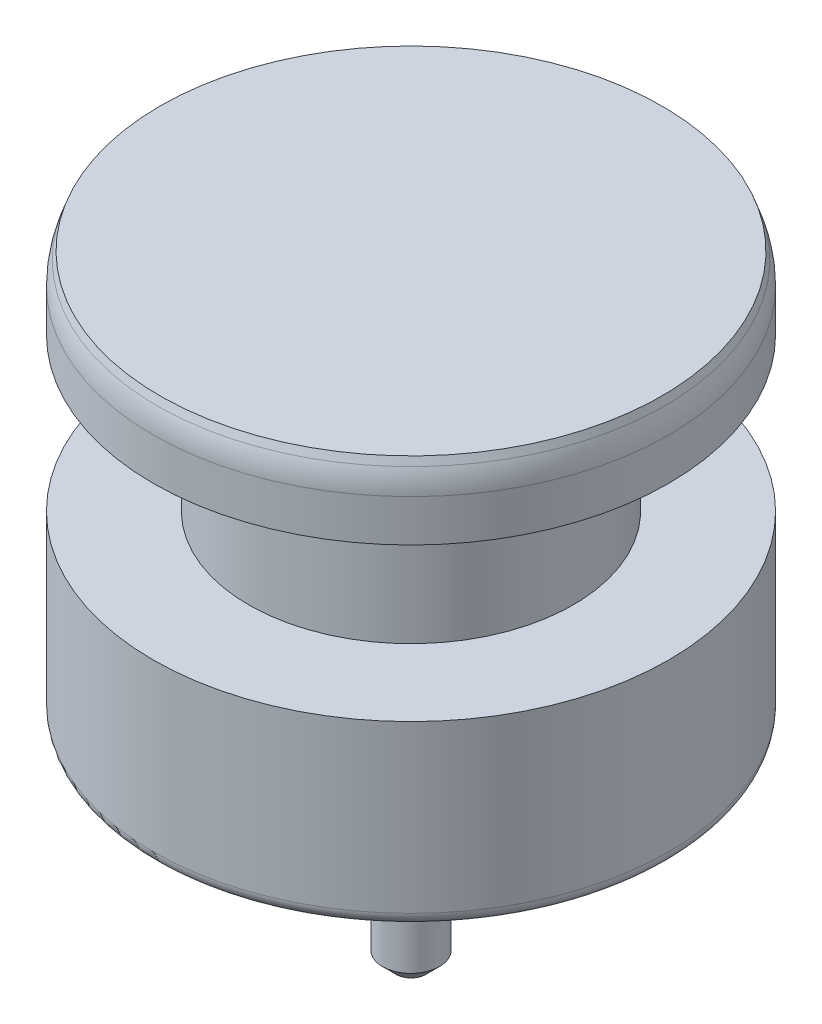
SolidWorks part; units mm, degrees
ref_plane "X_Y" through (0, 0, 0) normal (0, 0, 1) x (1, 0, 0)
ref_plane "Z_X" through (0, 0, 0) normal (0, 1, 0) x (1, 0, 0)
ref_plane "Y_Z" through (0, 0, 0) normal (1, 0, 0) x (0, 0, -1)
sketch "Sketch1" plane through (0, 0, 0) normal (0, 0, 1) x (1, 0, 0)
  line L0 (0, 0) -> (0, -9.15)
  line L2 (0.42, -7.8575) -> (3.81, -5.9003)
  line L3 (3.81, -5.9003) -> (3.81, -3.33)
  line L4 (3.81, -3.33) -> (2.4, -3.33)
  line L5 (2.4, -3.33) -> (2.4, -1.07)
  line L6 (2.4, -1.07) -> (3.81, -1.07)
  line L7 (3.81, -1.07) -> (3.81, -0.2747)
  line L8 (3.71, 0) -> (0, 0)
  line L10 (3.71, 0) -> (3.81, -0.2747)
  line L11 (0, -0.986) -> (0, -50000.986) construction
  line L12 (0.42, -7.8575) -> (0.42, -9.15)
  line L13 (0.42, -9.15) -> (0, -9.15)
  point P10 (0, -8.1)
  point P11 (2.4, -2.2)
  dimension "D1" = 5.9003
  dimension "D2" = 7.62
  dimension "D3" = 60
  dimension "D4" = 2.2
  dimension "D5" = 2.26
  dimension "D6" = 4.8
  dimension "D7" = 0.84
  dimension "D8" = 0.1
  dimension "D9" = 20
  dimension "D10" = 8.1
  dimension "D11" = 9.15
  dimension "D12" = 1.05
  dimension "D13" = 2.5703
  dimension "D14" = 3.7003
  dimension "D15" = 1.07
revolve "Revolve1" add sketch "Sketch1" angle 360 about L0
fillet "Fillet1" radius 0.2 1 edges at (-3.81, -5.9003, 0)
fillet "Fillet2" radius 1 1 edges at (-3.81, -0.2747, 0)
chamfer "Chamfer1" distance 0.2 angle 45 1 edges at (-0.42, -9.15, 0)
